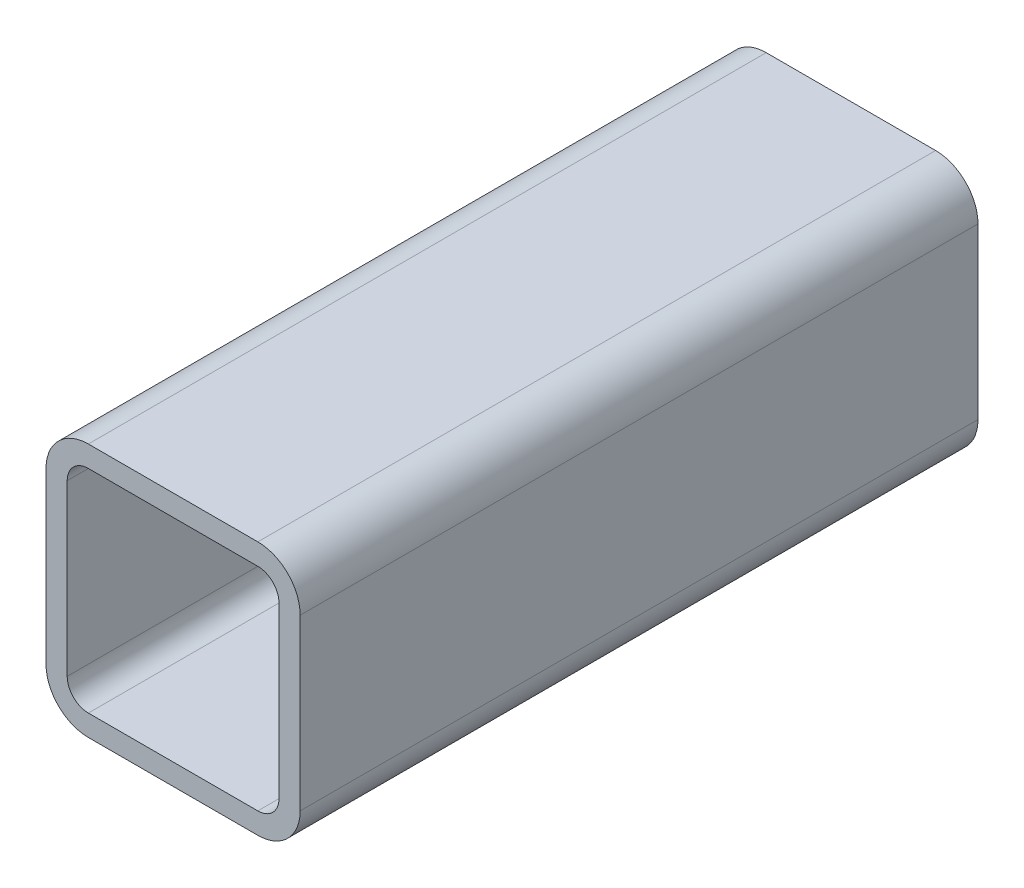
SolidWorks part; units mm, degrees
ref_plane "Front Plane" through (0, 0, 0) normal (0, 0, 1) x (1, 0, 0)
ref_plane "Top Plane" through (0, 0, 0) normal (0, 1, 0) x (1, 0, 0)
ref_plane "Right Plane" through (0, 0, 0) normal (1, 0, 0) x (0, 0, -1)
sketch "Sketch1" plane through (0, 0, 0) normal (0, 0, 1) x (1, 0, 0)
sketch_block_instance "HSS4.5x4.5x0.375-1"
sketch_block "HSS4.5x4.5x0.375"
extrude "Boss-Extrude1" add sketch "Sketch1" along normal blind 304.8
